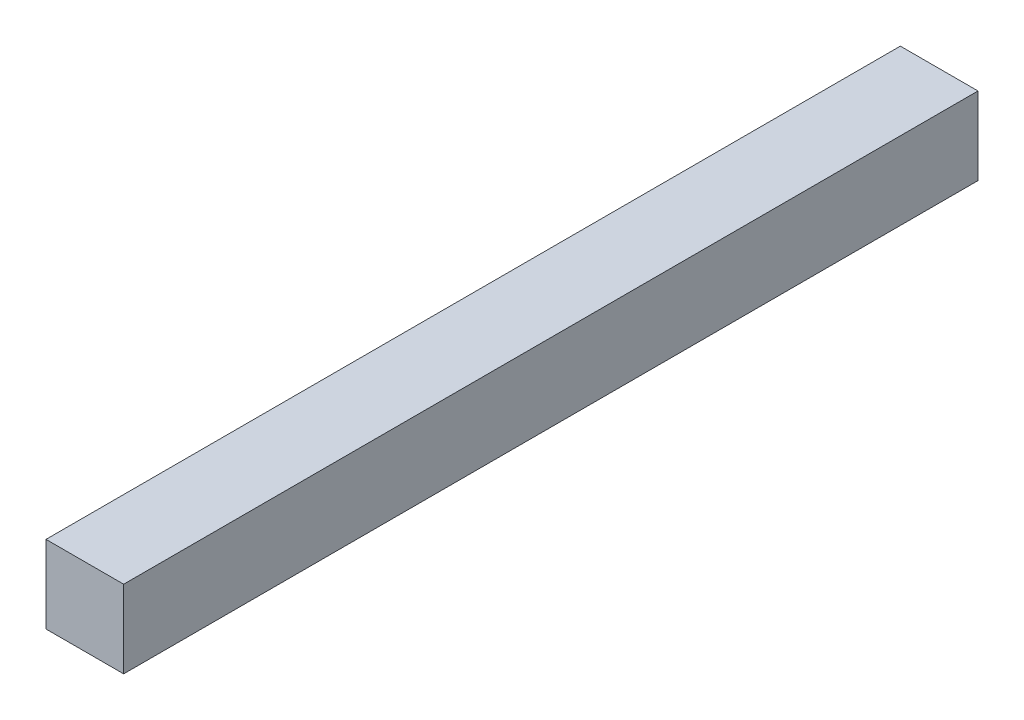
SolidWorks part; units mm, degrees
ref_plane "Piano frontale" through (0, 0, 0) normal (0, 0, 1) x (1, 0, 0)
ref_plane "Piano superiore" through (0, 0, 0) normal (0, 1, 0) x (1, 0, 0)
ref_plane "Piano destro" through (0, 0, 0) normal (1, 0, 0) x (0, 0, -1)
sketch "Sketch1" plane through (0, 0, 0) normal (0, 0, 1) x (1, 0, 0)
  line L1 (-2.5, -2.5) -> (2.5, -2.5)
  line L2 (-2.5, -2.5) -> (-2.5, 2.5)
  line L3 (-2.5, 2.5) -> (2.5, 2.5)
  line L4 (2.5, -2.5) -> (2.5, 2.5)
  line L5 (-2.5, -2.5) -> (2.5, 2.5) construction
  line L6 (-2.5, 2.5) -> (2.5, -2.5) construction
  point P0 (0, 0)
  dimension "D1" = 5
  dimension "D2" = 5
extrude "Boss-Extrude1" add sketch "Sketch1" along normal blind 55
